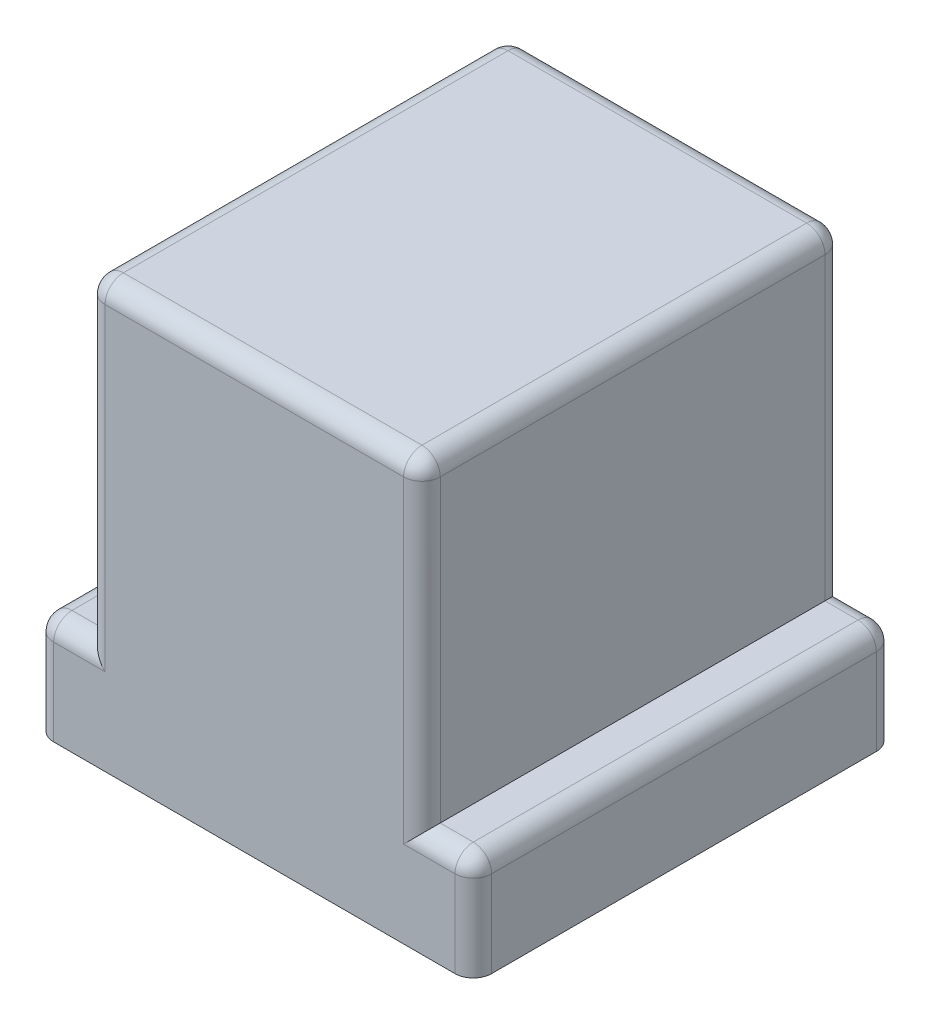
SolidWorks part; units mm, degrees
other "Cut-Extrude1"
ref_plane "Front Plane" through (0, 0, 0) normal (0, 0, 1) x (1, 0, 0)
ref_plane "Top Plane" through (0, 0, 0) normal (0, 1, 0) x (1, 0, 0)
ref_plane "Right Plane" through (0, 0, 0) normal (1, 0, 0) x (0, 0, -1)
imported_body "Imported1"
fillet "Fillet1" radius 1.27
shell "Shell1" thickness 0.254
